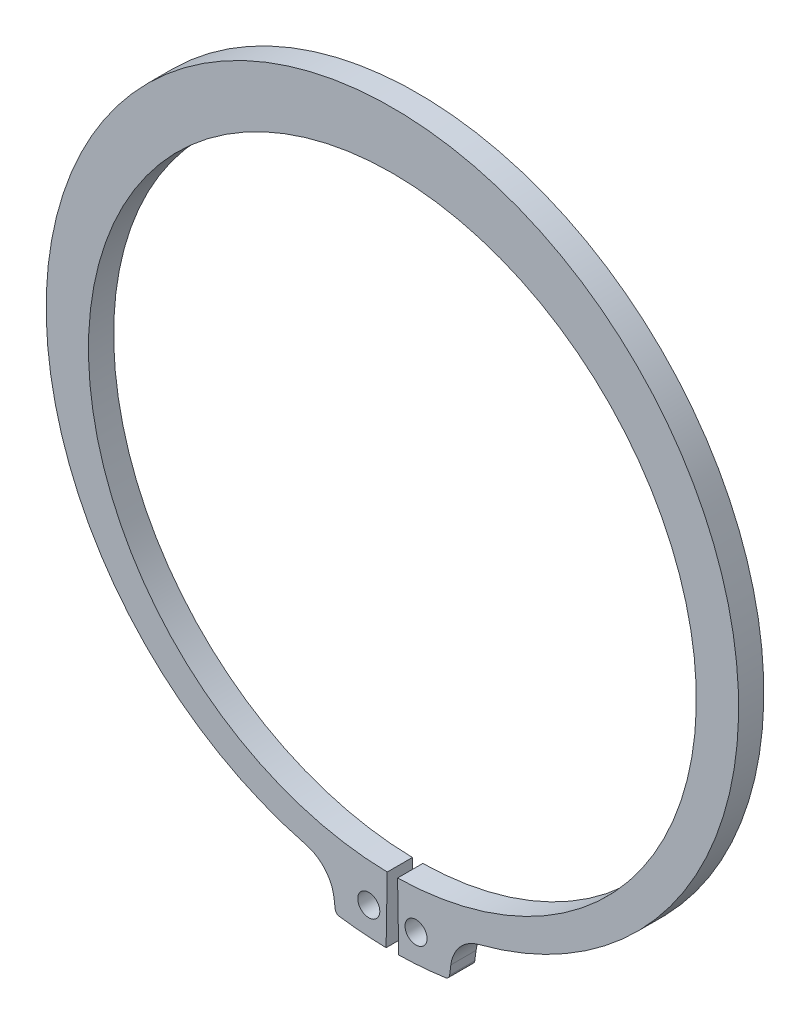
SolidWorks part; units mm, degrees
ref_plane "Plane1" through (0, 0, 0) normal (0, 0, 1) x (1, 0, 0)
ref_plane "Plane2" through (0, 0, 0) normal (0, 1, 0) x (1, 0, 0)
ref_plane "Plane3" through (0, 0, 0) normal (1, 0, 0) x (0, 0, -1)
sketch "Clipboard" plane through (0, 0, 0) normal (0, 0, 1) x (1, 0, 0)
  line L0 (0, 0) -> (9, 0)
  line L1 (0, 0) -> (0, 4.5)
  line L2 (0, 0) -> (0, -10.5)
  circle A0 centre (0, 0) radius 1.75
  circle A1 centre (0, 0) radius 50
sketch "BodySke" plane through (0, 0, 0) normal (0, 0, 1) x (1, 0, 0)
  line L0 (-1.5431, 0) -> (1.5431, 0) construction
  line L1 (0, 0) -> (0, 57.25) construction
  line L2 (0.8213, -48.243) -> (1, -58.7415)
  line L3 (-0.8213, -48.243) -> (-1, -58.7415)
  line L4 (0, 0) -> (15.2272, -56.7424) construction
  line L5 (0, 0) -> (-15.2272, -56.7424) construction
  line L7 (9.2788, -55.9592) -> (9.0765, -57.4962)
  line L8 (-9.2788, -55.9592) -> (-9.0765, -57.4962)
  circle A0 centre (0, 0) radius 48.25 construction
  arc A1 (0.8213, -48.243) -> (-0.8213, -48.243) centre (0, 0) ccw
  arc A2 (13.672, -50.9474) -> (-13.672, -50.9474) centre (0, 2.2875) ccw construction
  arc A3 (1, -58.7415) -> (8.4406, -58.1405) centre (0, 0) ccw
  arc A4 (13.7286, -50.9329) -> (9.2788, -55.9592) centre (15.2272, -56.7424) ccw
  arc A5 (-9.2788, -55.9592) -> (-13.7286, -50.9329) centre (-15.2272, -56.7424) ccw
  arc A6 (-8.4406, -58.1405) -> (-1, -58.7415) centre (0, 0) ccw
  arc A7 (13.7286, -50.9329) -> (-13.7286, -50.9329) centre (0, 2.2875) ccw
  arc A8 (-9.5998, -53.5209) -> (9.5998, -53.5209) centre (0, 0) ccw construction
  circle A9 centre (3.75, -54.2455) radius 1.75
  circle A10 centre (-3.75, -54.2455) radius 1.75
  arc A11 (9.0765, -57.4962) -> (8.4406, -58.1405) centre (8.3329, -57.3983) cw
  arc A12 (-9.0765, -57.4962) -> (-8.4406, -58.1405) centre (-8.3329, -57.3983) ccw
  point P28 (9.0027, -58.0561)
  point P31 (-9.0027, -58.0561)
extrude "Body" add sketch "BodySke" against normal blind 4
sketch "NotSke" plane through (0, 0, 0) normal (0, 0, 1) x (1, 0, 0)
  line L0 (3.75, -52.4955) -> (3.75, -55.9955)
  line L1 (3.75, -55.9955) -> (-3.75, -55.9955)
  line L2 (-3.75, -55.9955) -> (-3.75, -52.4955)
  line L3 (-3.75, -52.4955) -> (3.75, -52.4955)
  circle A0 centre (3.75, -54.2455) radius 1.75 construction
  circle A1 centre (-3.75, -54.2455) radius 1.75 construction
extrude "Notch" [suppressed] cut sketch "NotSke" against normal through all
sketch "UnlSke" plane through (0, 0, 0) normal (0, 0, 1) x (1, 0, 0)
  line L0 (-5.9359, -58.4494) -> (-4.875, -48.0031)
  line L1 (5.9359, -58.4494) -> (4.875, -48.0031)
  arc A0 (4.875, -48.0031) -> (-4.875, -48.0031) centre (0, 0) ccw
  arc A1 (5.9359, -58.4494) -> (-5.9359, -58.4494) centre (0, 0) ccw
  arc A2 (1, -58.7415) -> (8.4406, -58.1405) centre (0, 0) ccw construction
  arc A3 (0.8213, -48.243) -> (-0.8213, -48.243) centre (0, 0) ccw construction
  circle A4 centre (-3.75, -54.2455) radius 1.75 construction
  circle A5 centre (3.75, -54.2455) radius 1.75 construction
extrude "Unlug" [suppressed] add sketch "UnlSke" against normal through all
equation "' \"ShaftDia@Clipboard\" = 15"
equation "' \"Thickness@Body\" = 1.5"
equation "' \"GrooveDia@BodySke\" = 14.3"
equation "' \"LugSection@Clipboard\" = 4.8"
equation "' \"LargeSection@Clipboard\" = 2.4"
equation "' \"HoleDia@Clipboard\" = 2.0"
equation "' \"ShaftDia@Clipboard\" = 50"
equation "' \"Thickness@Body\" = 3"
equation "' \"GrooveDia@BodySke\" = 47"
equation "' \"LugSection@Clipboard\" = 8"
equation "' \"LargeSection@Clipboard\" = 5.1"
equation "' \"HoleDia@Clipboard\" = 2.5"
equation "\"SmallSection@Clipboard\" = \"LargeSection@Clipboard\" * 0.5"
equation "\"Gap@BodySke\" =  \"Thickness@Body\" / 2"
equation "\"LargeRad@BodySke\" =  \"GrooveDia@BodySke\" / 2 +  \"LargeSection@Clipboard\""
equation "\"SmallRad@BodySke\" =  \"GrooveDia@BodySke\" / 2 +  \"SmallSection@Clipboard\""
equation "\"LugRad@BodySke\" = \"GrooveDia@BodySke\" / 2 + \"LugSection@Clipboard\""
equation "\"HoleOffsetRad@BodySke\" = (  \"ShaftDia@Clipboard\" / 2 + \"LugRad@BodySke\" ) / 2"
equation "\"HoleSpacing@BodySke\" = \"Gap@BodySke\"  * 2 +  \"HoleDia@Clipboard\""
equation "\"HoleDia@BodySke\" =  \"HoleDia@Clipboard\""
equation "\"SmallAngle@BodySke\" = atn(\"HoleSpacing@BodySke\" / 2 / sqr(\"HoleOffsetRad@BodySke\"  * \"HoleOffsetRad@BodySke\" - (\"HoleSpacing@BodySke\" / 2) * (\"HoleSpacing@BodySke\" / 2) ))  * 7 *  (\"LargeRad@BodySke\""
